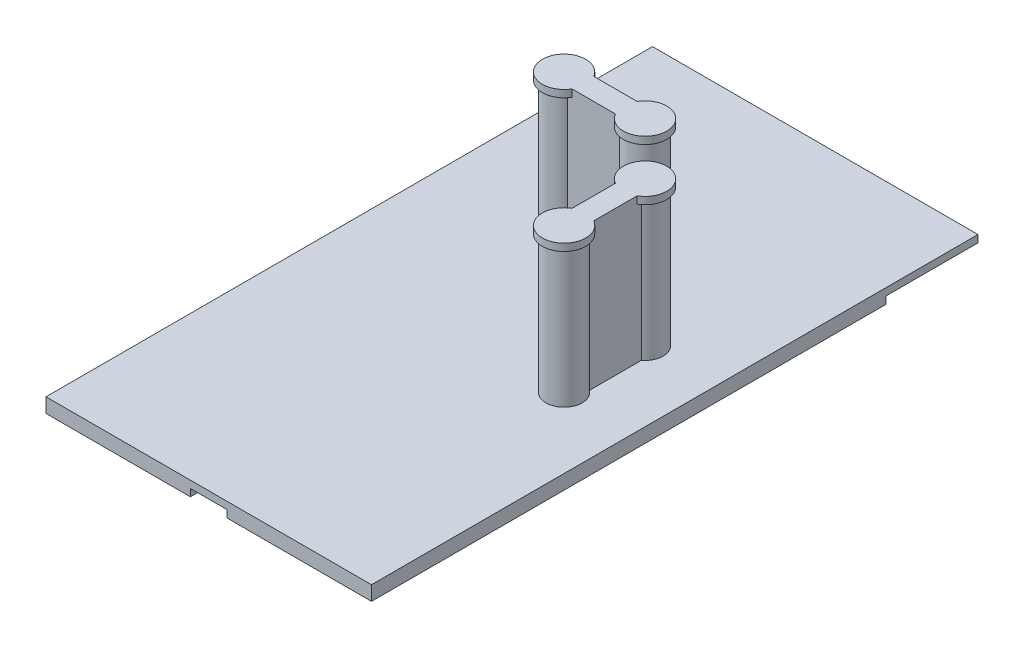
SolidWorks part; units mm, degrees
ref_plane "Front Plane" through (0, 0, 0) normal (0, 0, 1) x (1, 0, 0)
ref_plane "Top Plane" through (0, 0, 0) normal (0, 1, 0) x (1, 0, 0)
ref_plane "Right Plane" through (0, 0, 0) normal (1, 0, 0) x (0, 0, -1)
sketch "Sketch1" plane through (0, 0, 0) normal (0, 1, 0) x (1, 0, 0)
  line L1 (22.5, -41.93) -> (-22.5, -41.93)
  line L2 (22.5, -41.93) -> (22.5, 41.93)
  line L3 (22.5, 41.93) -> (-22.5, 41.93)
  line L4 (-22.5, -41.93) -> (-22.5, 41.93)
  line L5 (22.5, -41.93) -> (-22.5, 41.93) construction
  line L6 (22.5, 41.93) -> (-22.5, -41.93) construction
  point P0 (0, 0)
  dimension "D1" = 83.86
  dimension "D2" = 45
extrude "Boss-Extrude1" add sketch "Sketch1" along normal blind 2
sketch "Sketch3" plane through (0, 0, 0) normal (0, -1, 0) x (1, 0, 0)
  line L0 (22.5, -41.93) -> (-22.5, -41.93) construction
  line L1 (22.5, -54.63) -> (-22.5, -54.63)
  line L2 (22.5, -54.63) -> (22.5, -29.23)
  line L3 (22.5, -29.23) -> (-22.5, -29.23)
  line L4 (-22.5, -54.63) -> (-22.5, -29.23)
  line L5 (22.5, -54.63) -> (-22.5, -29.23) construction
  line L6 (22.5, -29.23) -> (-22.5, -54.63) construction
  point P0 (0, -41.93)
  dimension "D1" = 45
  dimension "D2" = 25.4
extrude "Cut-Extrude1" cut sketch "Sketch3" against normal blind 1
sketch "Sketch4" plane through (0, 0, 0) normal (0, -1, 0) x (1, 0, 0)
  line L0 (0, 0) -> (0, 41.93) construction
  line L1 (-22.5, 41.93) -> (22.5, 41.93) construction
  line L3 (2.54, 16.53) -> (-2.54, 16.53)
  line L4 (2.54, 16.53) -> (2.54, 41.93)
  line L5 (2.54, 41.93) -> (-2.54, 41.93)
  line L6 (-2.54, 16.53) -> (-2.54, 41.93)
  line L7 (2.54, 16.53) -> (-2.54, 41.93) construction
  line L8 (2.54, 41.93) -> (-2.54, 16.53) construction
  line L9 (5.6, -5.6) -> (-5.6, -5.6) construction
  line L10 (5.6, -5.6) -> (5.6, 5.6) construction
  line L11 (5.6, 5.6) -> (-5.6, 5.6) construction
  line L12 (-5.6, -5.6) -> (-5.6, 5.6) construction
  line L13 (5.6, -5.6) -> (-5.6, 5.6) construction
  line L14 (5.6, 5.6) -> (-5.6, -5.6) construction
  point P5 (0, 29.23)
  dimension "D1" = 25.4
  dimension "D2" = 5.08
  dimension "D3" = 11.2
  dimension "D4" = 11.2
extrude "Cut-Extrude2" cut sketch "Sketch4" against normal blind 1
sketch "Sketch5" plane through (0, 2, 0) normal (0, 1, 0) x (1, 0, 0)
  line L0 (5.6, 5.6) -> (5.6, 20) construction
  line L1 (5.6, -5.6) -> (-5.6, -5.6) construction
  line L2 (5.6, -5.6) -> (5.6, 5.6) construction
  line L3 (5.6, 5.6) -> (-5.6, 5.6) construction
  line L4 (-5.6, -5.6) -> (-5.6, 5.6) construction
  line L5 (5.6, -5.6) -> (-5.6, 5.6) construction
  line L6 (5.6, 5.6) -> (-5.6, -5.6) construction
  line L7 (20, -20) -> (-20, -20) construction
  line L8 (20, -20) -> (20, 20) construction
  line L9 (20, 20) -> (-20, 20) construction
  line L10 (-20, -20) -> (-20, 20) construction
  line L11 (20, -20) -> (-20, 20) construction
  line L12 (20, 20) -> (-20, -20) construction
  line L14 (-5.6, 5.6) -> (-5.6, 20) construction
  line L15 (5.6, 5.6) -> (20, 5.6) construction
  line L17 (5.6, -5.6) -> (20, -5.6) construction
  line L19 (11.3, -5.6) -> (14.3, -5.6)
  line L20 (11.3, -5.6) -> (11.3, 5.6)
  line L21 (11.3, 5.6) -> (14.3, 5.6)
  line L22 (14.3, -5.6) -> (14.3, 5.6)
  line L23 (-5.6, 14.3) -> (5.6, 14.3)
  line L24 (-5.6, 14.3) -> (-5.6, 11.3)
  line L25 (-5.6, 11.3) -> (5.6, 11.3)
  line L26 (5.6, 14.3) -> (5.6, 11.3)
  circle A0 centre (-5.6, 12.8) radius 2.5
  circle A1 centre (5.6, 12.8) radius 2.5
  circle A2 centre (12.8, 5.6) radius 2.5
  circle A3 centre (12.8, -5.6) radius 2.5
  point P0 (0, 0)
  point P6 (0, 0)
  point P12 (12.8, 5.6)
  point P13 (12.8, 5.6)
  point P25 (-5.6, 12.8)
  point P26 (-5.6, 12.8)
  dimension "D7" = 5
  dimension "D1" = 11.2
  dimension "D2" = 11.2
  dimension "D3" = 40
  dimension "D4" = 40
  dimension "D5" = 3
  dimension "D6" = 3
extrude "Boss-Extrude2" add sketch "Sketch5" along normal blind 20 contours L20 A3 L22 L19 | L22 A3 L20 L19 | A3 L22 A2 L20 | L20 A2 L22 L21 | L22 A2 L20 L21 | L23 A0 L25 L24 | L25 A0 L23 L24 | A1 L23 A0 L25 | L23 A1 L25 L26 | L25 A1 L23 L26
sketch "Sketch6" plane through (0, 22, 0) normal (0, 1, 0) x (1, 0, 0)
  line L0 (-3.0019, 14.3) -> (3.0019, 14.3)
  line L1 (-3.6, 14.3) -> (3.6, 14.3) construction
  line L2 (-3.0019, 11.3) -> (3.0019, 11.3)
  line L3 (-3.6, 11.3) -> (3.6, 11.3) construction
  line L4 (11.3, 3.0019) -> (11.3, -3.0019)
  line L5 (11.3, -3.6) -> (11.3, 3.6) construction
  line L6 (14.3, 3.0019) -> (14.3, -3.0019)
  line L7 (14.3, -3.6) -> (14.3, 3.6) construction
  line L8 (14.3, -3.6) -> (14.3, 3.6) construction
  circle A0 centre (-5.6, 12.8) radius 3
  circle A1 centre (5.6, 12.8) radius 3
  circle A2 centre (12.8, 5.6) radius 3
  circle A3 centre (12.8, -5.6) radius 3
  dimension "D1" = 6
extrude "Boss-Extrude3" add sketch "Sketch6" against normal blind 1 contours A0 M6 M8 M5 | A0 M8 M6 M5 | A1 A0 M8 M6 | A1 M6 M8 M7 | A1 M8 M6 M7 | A2 | A3 L6 A2 L4 | A3
